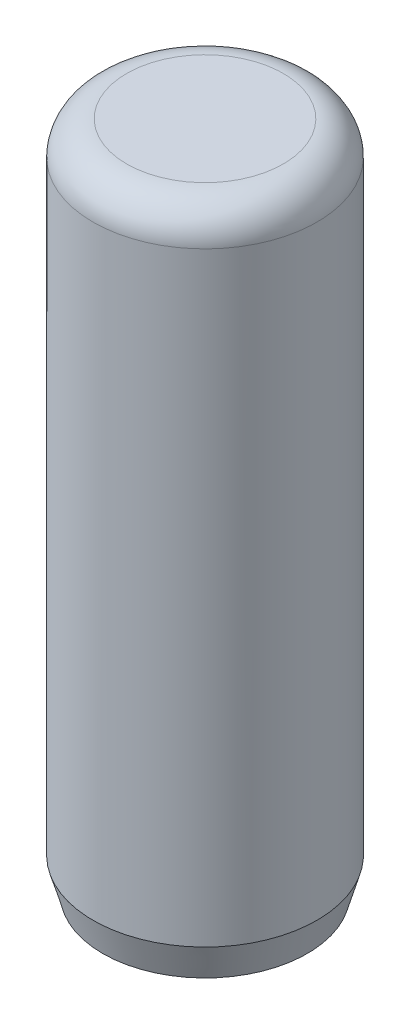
SolidWorks part; units mm, degrees
ref_plane "Plane1" through (0, 0, 0) normal (0, 0, 1) x (1, 0, 0)
ref_plane "Plane2" through (0, 0, 0) normal (0, 1, 0) x (1, 0, 0)
ref_plane "Plane3" through (0, 0, 0) normal (1, 0, 0) x (0, 0, -1)
sketch "Sketch1" plane through (0, 0, 0) normal (0, 0, 1) x (1, 0, 0)
  line L0 (0, 0) -> (6.35, 0)
  line L1 (0, 0) -> (0, 38.1)
  line L2 (6.35, 38.1) -> (0, 38.1)
  line L3 (6.35, 38.1) -> (6.35, 0)
  line L4 (0, 0) -> (0, 58.42) construction
  dimension "Length" = 38.1
  dimension "Radius" = 6.35
revolve "Base-Revolve" add sketch "Sketch1" angle 360 about L4
fillet "Fillet1" radius 1.905 1 edges at (0, 38.1, -6.35)
chamfer "Chamfer1" distance 1.905 angle 16 1 edges at (0, 0, -6.35)
